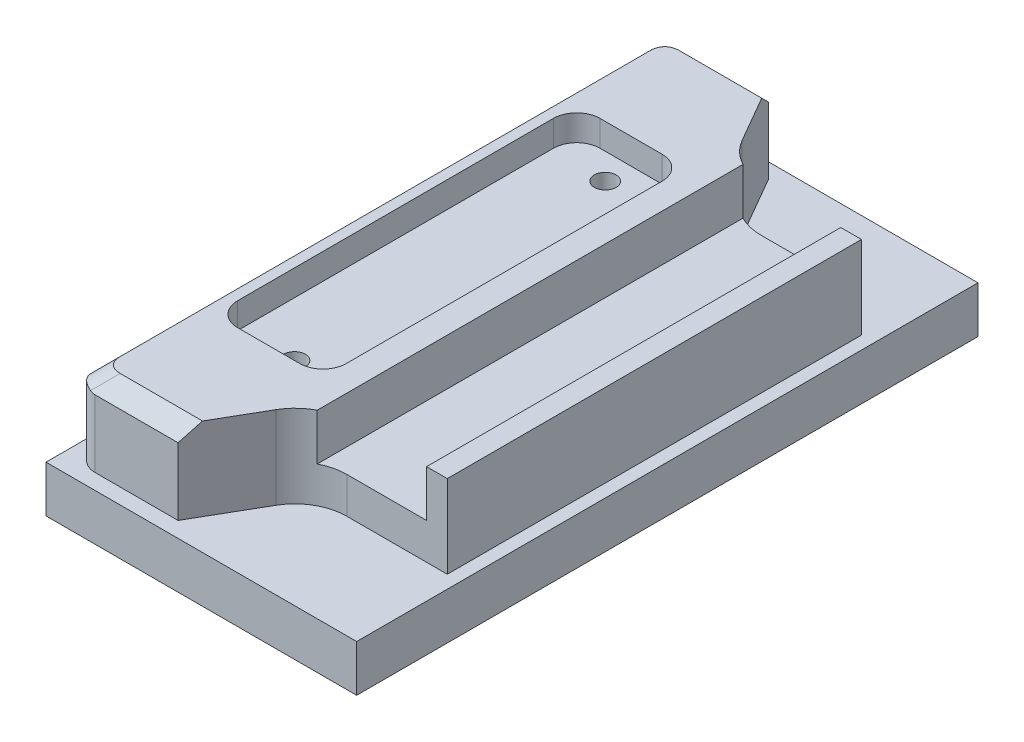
SolidWorks part; units mm, degrees
ref_plane "Plan1" through (0, 0, 0) normal (0, 0, 1) x (1, 0, 0)
ref_plane "Plan2" through (0, 0, 0) normal (0, 1, 0) x (1, 0, 0)
ref_plane "Plan3" through (0, 0, 0) normal (1, 0, 0) x (0, 0, -1)
sketch "Esquisse1" plane through (0, 0, 0) normal (0, 0, 1) x (1, 0, 0)
  line L1 (0, 0) -> (55, 0)
  line L2 (0, 0) -> (0, 16)
  line L3 (0, 16) -> (55, 16)
  line L4 (55, 0) -> (55, 16)
  dimension "D1" = 55
  dimension "D2" = 16
extrude "Base-Extrusion" add sketch "Esquisse1" along normal mid plane 114
chamfer "Chanfrein2" distance 3 angle 45 3 edges at (27.5, 16, 57) (27.5, 16, -57) (0, 16, 0)
sketch "Esquisse15"
  line L0 (25, 0) -> (-67, 0) construction
  line L1 (-55, 40) -> (-29.815, 40)
  line L2 (-55, 54) -> (-55, -54) construction
  line L3 (-29.815, 40) -> (-20, 57)
  line L4 (-55, 57) -> (0, 57) construction
  line L5 (-20, 57) -> (-55, 57)
  line L6 (-55, 57) -> (-55, 40)
  line L7 (-55, -57) -> (-55, -40)
  line L8 (-20, -57) -> (-55, -57)
  line L9 (-29.815, -40) -> (-20, -57)
  line L10 (-55, -40) -> (-29.815, -40)
  line L11 (0, 57) -> (0, -57) construction
fillet "Congé4" radius 4 2 edges at (0, 6.5, 57) (0, 6.5, -57)
fillet "Congé6" radius 4 4 edges at (2.0858, 15.0858, -54.9142) (2.0858, 15.0858, 54.9142) (0.3045, 13.3045, -54.5307) (2.4693, 13.3045, 56.6955)
extrude "Enlèv. mat.-Extru.7" cut sketch "Esquisse15" against normal through all
fillet "Congé9" radius 10 2 edges at (29.815, 8, -40) (29.815, 8, 40)
sketch "Esquisse10" plane through (0, 16, 0) normal (0, 1, 0) x (-1, 0, 0)
  line L1 (-26, 35) -> (-5, 35)
  line L2 (-26, 35) -> (-26, -35)
  line L3 (-26, -35) -> (-5, -35)
  line L4 (-5, 35) -> (-5, -35)
  line L5 (0, 53) -> (0, -53) construction
  line L6 (-38, 0) -> (15, 0) construction
  dimension "D1" = 70
  dimension "D2" = 21
  dimension "D4" = 5
extrude "Enlèv. mat.-Extru.6" cut sketch "Esquisse10" against normal blind 5
fillet "Congé8" radius 4.5 4 edges at (26, 13.5, -35) (26, 13.5, 35) (5, 13.5, 35) (5, 13.5, -35)
hole_wizard "Chambrage pour vis à tête ronde bombée M51" positions "Esquisse12" profile "Esquisse11" counterbore size "M5" standard "Ansi Métrique"
sketch "Esquisse12" plane through (0, 0, 0) normal (0, -1, 0) x (1, 0, 0)
  line L0 (0, 53) -> (0, -53) construction
  line L1 (4, -57) -> (20, -57) construction
  point P0 (15.5, -30)
  dimension "D1" = 15.5
  dimension "D2" = 27
sketch "Esquisse11" plane through (15.5, 0, -30) normal (1, 0, 0) x (0, 0, -1)
  line L0 (0, 0) -> (0, 11)
  line L1 (0, 11) -> (2.1, 11)
  line L3 (2.1, 11) -> (2.1, 5)
  line L4 (2.1, 5) -> (3.6, 5)
  line L5 (3.6, 5) -> (3.6, 0)
  line L7 (3.6, 0) -> (0, 0)
  line L11 (0, -6.35) -> (0, 107.95) construction
  dimension "Diamètre du perçage jusqu'au prochain" = 4.2
  dimension "Profondeur du perçage jusqu'au prochain" = 11
  dimension "Diamètre du chambrage" = 7.2
  dimension "Profondeur du chambrage" = 5
hole_wizard "Chambrage pour vis à tête ronde bombée M41" positions "Esquisse14" profile "Esquisse13" counterbore size "M4" standard "Ansi Métrique"
sketch "Esquisse14" plane through (0, 0, 0) normal (0, -1, 0) x (1, 0, 0)
  line L0 (0, 53) -> (0, -53) construction
  line L1 (4, 57) -> (20, 57) construction
  point P0 (15.5, 30)
  dimension "D1" = 15.5
  dimension "D2" = 27
sketch "Esquisse13" plane through (15.5, 0, 30) normal (1, 0, 0) x (0, 0, -1)
  line L0 (0, 0) -> (0, 11)
  line L1 (0, 11) -> (2.1, 11)
  line L3 (2.1, 11) -> (2.1, 5)
  line L4 (2.1, 5) -> (3.6, 5)
  line L5 (3.6, 5) -> (3.6, 0)
  line L7 (3.6, 0) -> (0, 0)
  line L11 (0, -6.35) -> (0, 107.95) construction
  dimension "Diamètre du perçage jusqu'au prochain" = 4.2
  dimension "Profondeur du perçage jusqu'au prochain" = 11
  dimension "Diamètre du chambrage" = 7.2
  dimension "Profondeur du chambrage" = 5
sketch "Esquisse16" plane through (0, 0, 0) normal (0, 0, 1) x (1, 0, 0)
  line L0 (55, 16) -> (35.5885, 16) construction
  line L1 (51, 16) -> (31, 16)
  line L2 (51, 16) -> (51, 7)
  line L3 (51, 7) -> (31, 7)
  line L4 (31, 16) -> (31, 7)
  line L5 (55, 0) -> (55, 16) construction
  dimension "D1" = 20
  dimension "D2" = 4
  dimension "D3" = 9
extrude "Enlèv. mat.-Extru.8" cut sketch "Esquisse16" against normal through all and the other way through all
sketch "Esquisse18" plane through (0, 0, 0) normal (0, -1, 0) x (1, 0, 0)
  line L0 (4, -57) -> (20, -57) construction
  line L1 (-2.5, -60) -> (57.5, -60)
  line L2 (-2.5, -60) -> (-2.5, 60)
  line L3 (-2.5, 60) -> (57.5, 60)
  line L4 (57.5, -60) -> (57.5, 60)
  line L5 (0, 53) -> (0, -53) construction
  dimension "D1" = 120
  dimension "D2" = 60
  dimension "D3" = 3
  dimension "D4" = 2.5
extrude "Extrusion2" add sketch "Esquisse18" along normal blind 9
ref_plane "Plan5" through (0, 17, 0) normal (0, 1, 0) x (-1, 0, 0)
sketch "Esquisse20" plane through (0, 17, 0) normal (0, 1, 0) x (-1, 0, 0)
  line L0 (2.5, 60) -> (2.5, -60) construction
  line L1 (2.5, -60) -> (-57.5, -60) construction
  line L2 (-57.5, -60) -> (-57.5, 60) construction
  line L3 (-57.5, 60) -> (2.5, 60) construction
  line L4 (2.5, 60) -> (2.5, -60)
  line L5 (2.5, -60) -> (-57.5, -60)
  line L6 (-57.5, -60) -> (-57.5, 60)
  line L7 (-57.5, 60) -> (2.5, 60)
sketch "Esquisse21" plane through (0, 16, 0) normal (0, 1, 0) x (-1, 0, 0)
  point P0 (0, 57)
ref_plane "Plan6" through (0, 16, 0) normal (0, 1, 0) x (-1, 0, 0)
sketch "Esquisse22" plane through (0, 16, 0) normal (0, 1, 0) x (-1, 0, 0)
  line L0 (-20, 57) -> (-4, 57) construction
  line L1 (0, 53) -> (0, -53) construction
  line L2 (-4, -57) -> (-20, -57) construction
  line L3 (-20, 57) -> (-4, 57)
  line L4 (0, 53) -> (0, -53)
  line L5 (-4, -57) -> (-20, -57)
  arc A0 (-0.1363, 54.0353) -> (-2.9647, 56.8637) centre (-4, 53) ccw construction
  arc A1 (-2.9647, -56.8637) -> (-0.1363, -54.0353) centre (-4, -53) ccw construction
  arc A2 (-0.1363, 54.0353) -> (-2.9647, 56.8637) centre (-4, 53) ccw
  arc A3 (-2.9647, -56.8637) -> (-0.1363, -54.0353) centre (-4, -53) ccw
